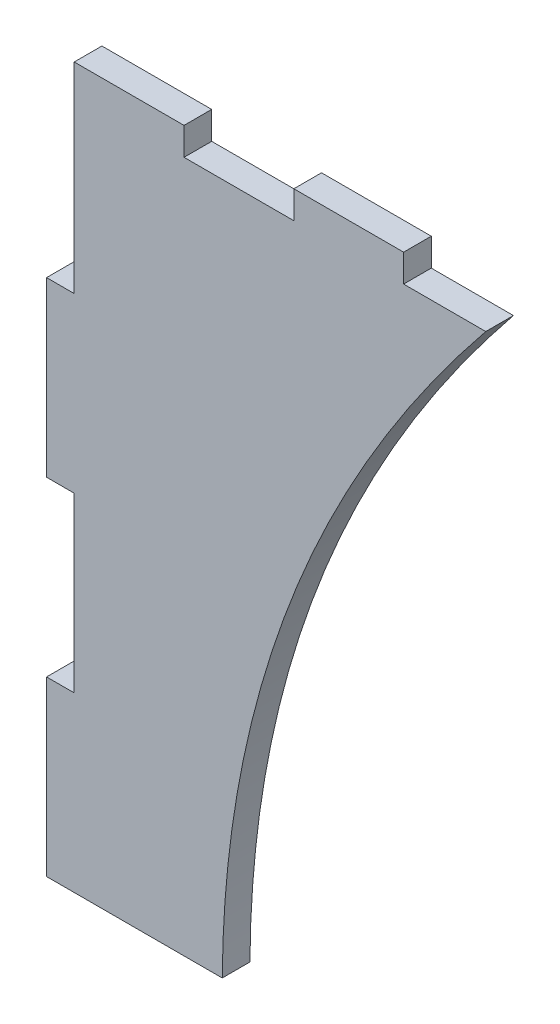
SolidWorks part; units mm, degrees
ref_plane "Front Plane" through (0, 0, 0) normal (0, 0, 1) x (1, 0, 0)
ref_plane "Top Plane" through (0, 0, 0) normal (0, 1, 0) x (1, 0, 0)
ref_plane "Right Plane" through (0, 0, 0) normal (1, 0, 0) x (0, 0, -1)
sketch "Sketch1" plane through (0, 0, 0) normal (0, 0, 1) x (1, 0, 0)
  line L4 (-845.3711, -117.8903) -> (-829.0872, -117.8903)
  line L5 (-850.503, -317.2803) -> (-829.0872, -317.2803)
  line L6 (-839.7951, 97.2092) -> (-839.7951, -317.2803) construction
  line L7 (-845.3711, -18.1953) -> (-845.3711, -117.8903)
  line L8 (-845.3711, -217.5853) -> (-836.8915, -217.5853)
  line L9 (-845.3711, -217.5853) -> (-845.3711, -317.2803)
  line L10 (-845.3711, -317.2803) -> (-829.0872, -317.2803)
  line L11 (-829.0872, -117.8903) -> (-836.8915, -217.5853)
  line L12 (-845.3711, -217.5853) -> (-829.0872, -317.2803) construction
  line L13 (-845.3711, -317.2803) -> (-836.8915, -217.5853) construction
  line L14 (-845.3711, -18.1953) -> (-836.8915, -18.1953)
  line L18 (-836.8915, 82.6436) -> (-836.8915, -18.1953)
  line L22 (-582.8918, 66.0011) -> (-591.9816, 56.1662)
  arc A0 (-735.2915, -317.2803) -> (-591.9816, 56.1662) centre (-178.7635, -316.6268) cw
  point P9 (-839.7951, -251.7233)
sketch "Sketch2" plane through (0, 0, 0) normal (0, 0, 1) x (1, 0, 0)
  line L0 (0, 300) -> (0, 200)
  line L1 (0, 100) -> (16, 100)
  line L2 (16, 300) -> (16, 416)
  line L3 (16, 200) -> (0, 200)
  line L4 (79.5, 400) -> (143, 400)
  line L5 (0, 300) -> (16, 300)
  line L6 (0, 100) -> (0, 0)
  line L7 (16, 100) -> (16, 200)
  line L9 (79.5, 416) -> (16, 416)
  line L10 (0, 0) -> (101.6, 0)
  line L11 (79.5, 416) -> (79.5, 400)
  line L13 (143, 400) -> (143, 416)
  line L15 (206.5, 416) -> (206.5, 400)
  line L17 (143, 416) -> (206.5, 416)
  line L19 (206.5, 400) -> (254, 400)
  spline S0 degree 2 poles (254, 400) (103.2252, 213.7253) (101.6, 0) knots 0 0 0 0.978672 0.978672 0.978672
extrude "Boss-Extrude1" add sketch "Sketch2" along normal blind 16
equation "\"thickness of material\"= 16mm"
equation "\"length\"= 400mm"
equation "\"width\"= 10in"
equation "\"D12@Sketch1\"=\"length\""
equation "\"D13@Sketch1\"=\"length\"/4"
equation "\"D6@Sketch1\"=\"length\""
equation "\"D5@Sketch1\"=\"length\"/4"
equation "\"D2@Sketch2\"=\"thickness of material\""
equation "\"D3@Sketch2\"=\"length\"/4"
equation "\"D4@Sketch2\"=\"length\"/4"
equation "\"D7@Sketch2\"=\"thickness of material\""
equation "\"D8@Sketch2\"=\"thickness of material\""
equation "\"D1@Boss-Extrude1\"=\"thickness of material\""
equation "\"D11@Sketch2\"=\"width\"/4"
equation "\"D12@Sketch2\"=\"width\"/4"
equation "\"D13@Sketch2\"=\"thickness of material\""
